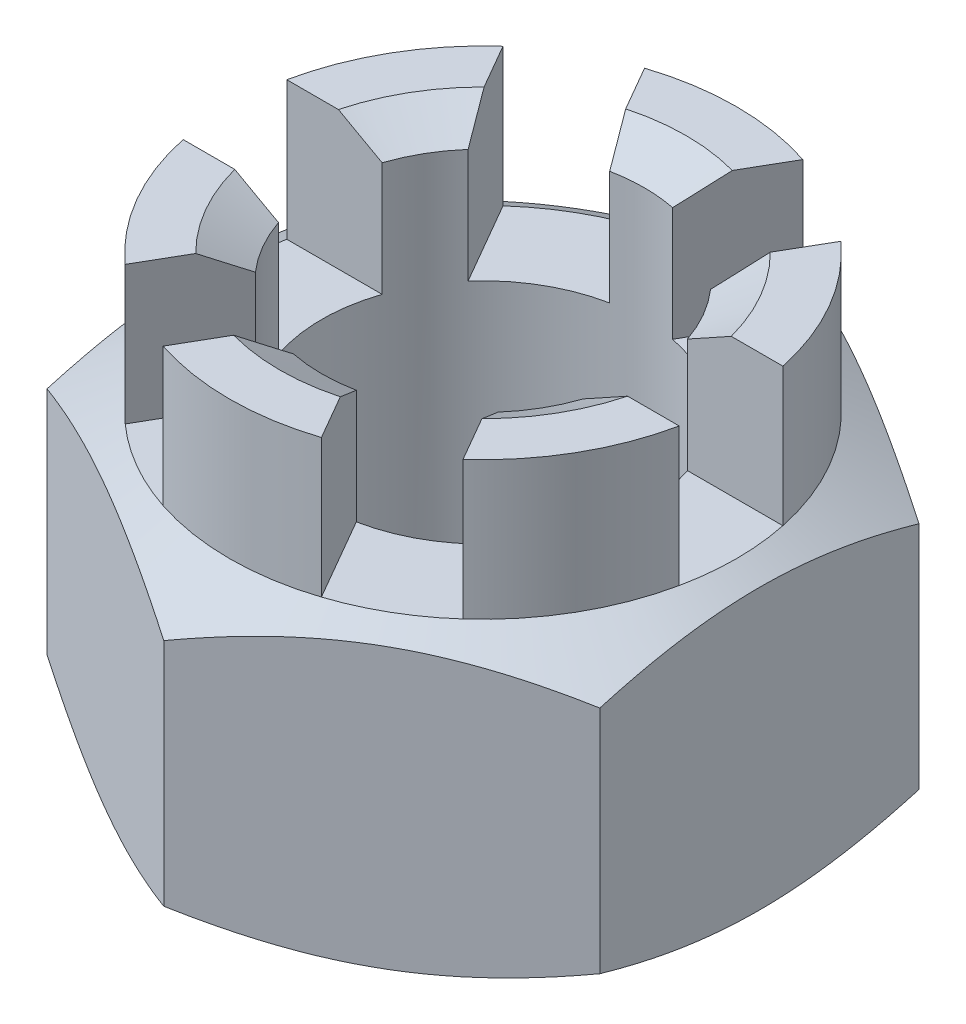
SolidWorks part; units mm, degrees
ref_plane "Front Plane" through (0, 0, 0) normal (0, 0, 1) x (1, 0, 0)
ref_plane "Top Plane" through (0, 0, 0) normal (0, 1, 0) x (1, 0, 0)
ref_plane "Right Plane" through (0, 0, 0) normal (1, 0, 0) x (0, 0, -1)
sketch "BaseNutSke" plane through (0, 0, 0) normal (0, 1, 0) x (1, 0, 0)
  line L1 (0, 13.8564) -> (-12, 6.9282)
  line L2 (-12, 6.9282) -> (-12, -6.9282)
  line L3 (-12, -6.9282) -> (0, -13.8564)
  line L4 (0, -13.8564) -> (12, -6.9282)
  line L5 (12, -6.9282) -> (12, 6.9282)
  line L6 (12, 6.9282) -> (0, 13.8564)
  circle A0 centre (0, 0) radius 12 construction
  dimension "Width" = 24
extrude "BaseNut" add sketch "BaseNutSke" along normal blind 19
ref_plane "MidPlane" through (0, 9.5, 0) normal (0, 1, 0) x (-1, 0, 0)
sketch "CutNutSke" plane through (0, 0, 0) normal (1, 0, 0) x (0, 0, -1)
  line L0 (-13.8564, 19) -> (-11.5, 19)
  line L1 (-11.5, 19) -> (-13.8564, 17.6395)
  line L2 (-13.8564, 17.6395) -> (-13.8564, 19)
  line L3 (0, 0) -> (0, 8.4136) construction
  dimension "Chamf_ang" = 30
  dimension "Chamfer_diameter" = 23
revolve "CutNut" cut sketch "CutNutSke" angle 360 about L3
mirror "MirrorChamfer" about plane through (0, 9.5, 0) normal (0, 1, 0) of "CutNut"
sketch "HoleSke" plane through (0, 0, 0) normal (0, 1, 0) x (1, 0, 0)
  circle A0 centre (0, 0) radius 7
  dimension "Tap_drill" = 14
extrude "TappedHole" cut sketch "HoleSke" along normal through all
chamfer "Chamfer1" distance 1.05 angle 60 2 edges at (0, 19, 7) (0, 0, 7)
sketch "SlotSke" plane through (0, 0, 0) normal (1, 0, 0) x (0, 0, -1)
  line L0 (0, 0) -> (0, 7.747) construction
  line L2 (-2.25, 32) -> (2.25, 32)
  line L3 (-2.25, 32) -> (-2.25, 13)
  line L4 (-2.25, 13) -> (2.25, 13)
  line L5 (2.25, 32) -> (2.25, 13)
  dimension "D1" = 19
  dimension "Slot_height" = 13
  dimension "Slot_width" = 4.5
extrude "Slot" cut sketch "SlotSke" against normal blind 28.8
pattern_circular "SlotPat" count 6 over 360 about axis through (0, 0, 0) along (0, 1, 0) of "Slot"
sketch "TopCutSke" plane through (0, 0, 0) normal (1, 0, 0) x (0, 0, -1)
  line L0 (-11, 32) -> (-11, 13)
  line L1 (-11, 13) -> (-33.5167, 0)
  line L2 (-33.5167, 0) -> (-33.5167, 32)
  line L3 (-33.5167, 32) -> (-11, 32)
  line L4 (0, 0) -> (0, 31.1327) construction
  line L5 (-11.5, 0) -> (11.5, 0) construction
  dimension "D1" = 60
  dimension "Top_diameter" = 22
  dimension "D2" = 13
  dimension "D3" = 19
revolve "TopCut" cut sketch "TopCutSke" angle 360 about L4
sketch "ThdSchSke" plane through (0, 0, 0) normal (0, 0, 1) x (1, 0, 0)
  line L0 (-8, 1.6274) -> (-7, 1.05)
  line L1 (-7, 1.05) -> (-5.8453, 1.05)
  line L2 (-5.8453, 1.05) -> (-5.8453, 2.2047)
  line L3 (-5.8453, 2.2047) -> (-7, 2.2047)
  line L4 (-7, 2.2047) -> (-8, 1.6274)
  line L5 (0, -3.4988) -> (0, 3.4988) construction
  line L8 (7, 1.05) -> (-7, 1.05) construction
  line L9 (7, 1.05) -> (-7, 1.05) construction
  dimension "ThreadN" = 16
  dimension "Tap_drill" = 14
revolve "ThreadSchematic" [suppressed] cut sketch "ThdSchSke" angle 360 about L5
pattern_linear "ThdSchPat" [suppressed]
equation "\"D1@Chamfer1\" = \"Tap_drill@HoleSke\"*0.075"
equation "\"D1@SlotSke\" = \"Height@BaseNut\""
equation "\"D1@Slot\" = \"Width@BaseNutSke\"*1.2"
equation "\"D2@TopCutSke\" = \"Slot_height@SlotSke\""
equation "\"D3@TopCutSke\" = \"Height@BaseNut\""
equation "\"Tap_drill@ThdSchSke\" = \"Tap_drill@HoleSke\""
equation "\"ThreadN@ThdSchSke\" = \"Thread_major@ThreadCosmetic\""
equation "\"Num_threads@ThdSchPat\" =  int(( \"Height@BaseNut\" - \"D1@Chamfer1\" *2) /\"Advance@ThdSchPat\" ) "
